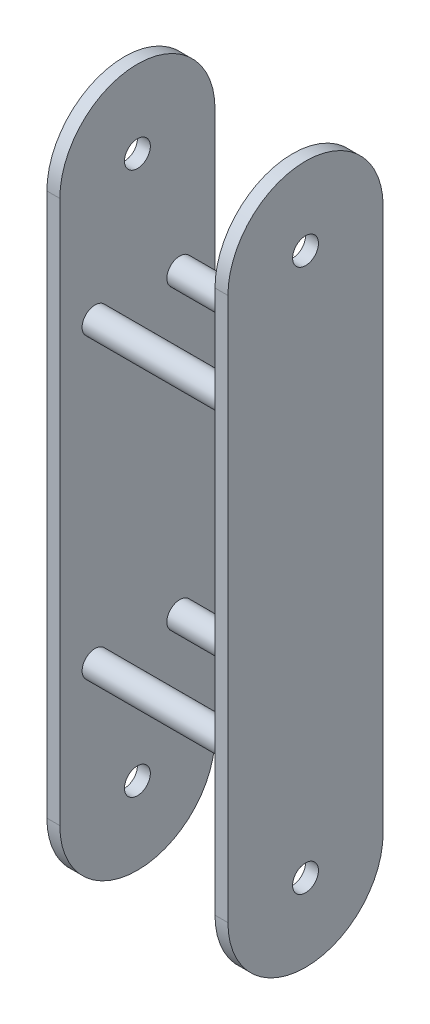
SolidWorks part; units mm, degrees
ref_plane "Front Plane" through (0, 0, 0) normal (0, 0, 1) x (1, 0, 0)
ref_plane "Top Plane" through (0, 0, 0) normal (0, 1, 0) x (1, 0, 0)
ref_plane "Right Plane" through (0, 0, 0) normal (1, 0, 0) x (0, 0, -1)
ref_plane "Plane1" through (35, 0, 0) normal (1, 0, 0) x (0, 0, -1)
sketch "Sketch1" plane through (35, 0, 0) normal (1, 0, 0) x (0, 0, -1)
  line L0 (0, 105) -> (0, -105)
  line L1 (-30, 105) -> (30, 105)
  line L2 (-30, 105) -> (-30, -105)
  line L3 (30, 105) -> (30, -105)
  arc A0 (-30, 105) -> (30, 105) centre (0, 105) cw
  arc A1 (-30, -105) -> (30, -105) centre (0, -105) ccw
  point P4 (0, 0)
  point P8 (0, 105)
  dimension "D1" = 210
  dimension "D2" = 60
extrude "Boss-Extrude1" add sketch "Sketch1" against normal blind 5
ref_plane "Plane2" through (-35, 0, 0) normal (1, 0, 0) x (0, 0, -1)
sketch "Sketch2" plane through (-35, 0, 0) normal (1, 0, 0) x (0, 0, -1)
  line L0 (-30, 105) -> (-30, -105) construction
  line L1 (30, 105) -> (30, -105) construction
  line L2 (-30, 105) -> (-30, -105)
  line L3 (30, 105) -> (30, -105)
  arc A0 (-30, -105) -> (30, -105) centre (0, -105) ccw construction
  arc A1 (30, 105) -> (-30, 105) centre (0, 105) ccw construction
  arc A2 (-30, -105) -> (30, -105) centre (0, -105) ccw
  arc A3 (30, 105) -> (-30, 105) centre (0, 105) ccw
extrude "Boss-Extrude2" add sketch "Sketch2" along normal blind 5 separate body
sketch "Sketch3" plane through (35, 0, 0) normal (1, 0, 0) x (0, 0, -1)
  circle A0 centre (0, 105) radius 5
  circle A1 centre (0, -105) radius 5
extrude "Cut-Extrude1" cut sketch "Sketch3" against normal through all
sketch "Sketch4" plane through (35, 0, 0) normal (1, 0, 0) x (0, 0, -1)
  line L0 (0, 38.5) -> (0, -38.5) construction
  line L1 (33, 0) -> (-33, 0) construction
  circle A0 centre (-16.3848, 57.5285) radius 5
  circle A1 centre (16.3848, 57.5285) radius 5
  circle A2 centre (16.3848, -57.5285) radius 5
  circle A3 centre (-16.3848, -57.5285) radius 5
extrude "Boss-Extrude3" add sketch "Sketch4" against normal through all
